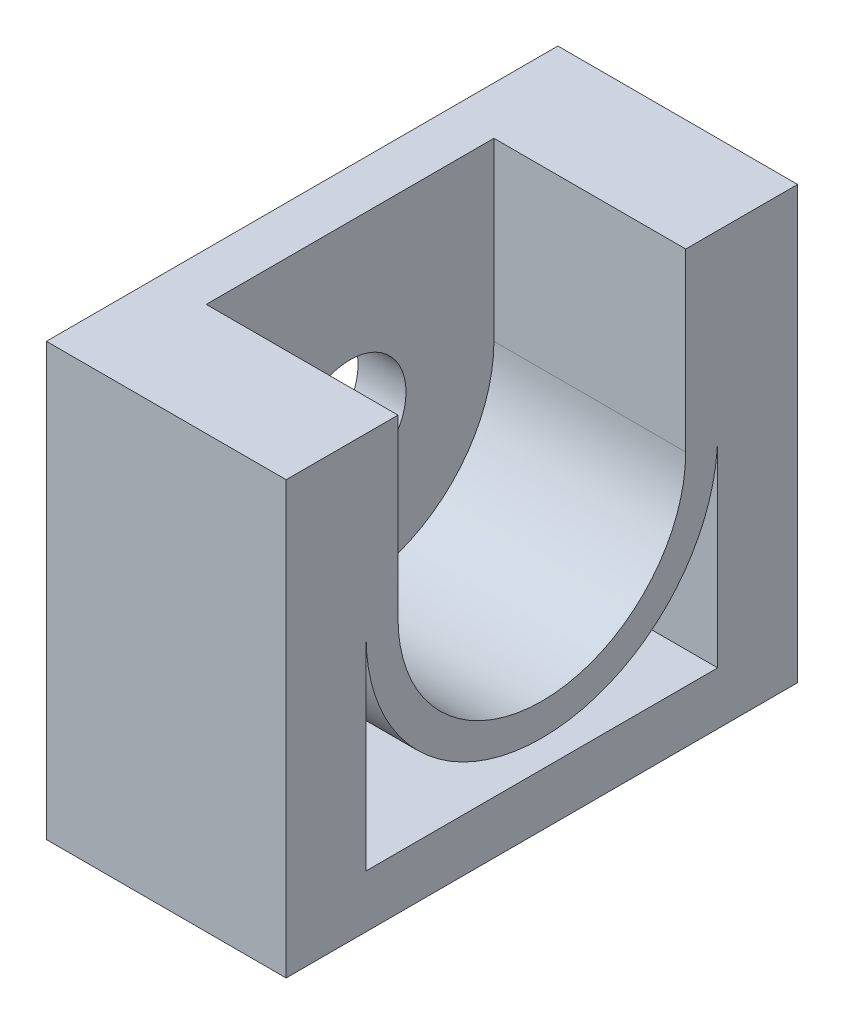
SolidWorks part; units mm, degrees
ref_plane "Front Plane" through (0, 0, 0) normal (0, 0, 1) x (1, 0, 0)
ref_plane "Top Plane" through (0, 0, 0) normal (0, 1, 0) x (1, 0, 0)
ref_plane "Right Plane" through (0, 0, 0) normal (1, 0, 0) x (0, 0, -1)
sketch "Sketch1" plane through (0, 0, 0) normal (1, 0, 0) x (0, 0, -1)
  line L2 (-11, 0) -> (-11, 11)
  line L3 (-11, 11) -> (11, 11)
  line L4 (11, 0) -> (11, 11)
  arc A0 (-11, 0) -> (11, 0) centre (0, 0) ccw
  dimension "D1" = 22
  dimension "D2" = 11
extrude "Boss-Extrude2" add sketch "Sketch1" along normal blind 15
sketch "Sketch2" plane through (15, 0, 0) normal (1, 0, 0) x (0, 0, -1)
  line L0 (11, 11) -> (-11, 11) construction
  line L2 (-9, 0) -> (-9, 11)
  line L3 (-9, 11) -> (9, 11)
  line L4 (9, 0) -> (9, 11)
  arc A0 (-9, 0) -> (9, 0) centre (0, 0) ccw
  dimension "D1" = 18
extrude "Cut-Extrude1" cut sketch "Sketch2" against normal blind 12 contours A0 L4 L3 L2
sketch "Sketch3" plane through (3, 0, 0) normal (1, 0, 0) x (0, 0, -1)
  circle A0 centre (0, 0) radius 3.5
  dimension "D1" = 7
extrude "Cut-Extrude2" cut sketch "Sketch3" against normal through all contours A0
sketch "Sketch4" plane through (0, 0, -11) normal (0, 0, -1) x (-1, 0, 0)
  line L1 (-15, 11) -> (0, 11)
  line L2 (-15, 11) -> (-15, 0)
  line L3 (-15, 0) -> (0, 0)
  line L4 (0, 11) -> (0, 0)
extrude "Boss-Extrude3" add sketch "Sketch4" along normal blind 5 contours L2 L1 L4 L3
sketch "Sketch5" plane through (0, 0, 0) normal (0, -1, 0) x (1, 0, 0)
  line L1 (0, -11) -> (15, -11)
  line L2 (0, -11) -> (0, -16)
  line L3 (0, -16) -> (15, -16)
  line L4 (15, -11) -> (15, -16)
extrude "Boss-Extrude5" add sketch "Sketch5" along normal blind 16 contours L2 L1 L4 L3
sketch "Sketch6" plane through (0, 0, 11) normal (0, 0, 1) x (1, 0, 0)
  line L1 (0, 11) -> (15, 11)
  line L2 (0, 11) -> (0, 0)
  line L3 (0, 0) -> (15, 0)
  line L4 (15, 11) -> (15, 0)
extrude "Boss-Extrude6" add sketch "Sketch6" along normal blind 5 contours L2 L1 L4 L3
sketch "Sketch7" plane through (0, 0, 0) normal (0, -1, 0) x (1, 0, 0)
  line L1 (0, 16) -> (15, 16)
  line L2 (0, 16) -> (0, 11)
  line L3 (0, 11) -> (15, 11)
  line L4 (15, 16) -> (15, 11)
extrude "Boss-Extrude7" add sketch "Sketch7" along normal blind 16 contours L2 L1 L4 L3
sketch "Sketch8" plane through (0, 0, 11) normal (0, 0, -1) x (-1, 0, 0)
  line L0 (0, -16) -> (0, 0) construction
  line L1 (-15, -16) -> (0, -16)
  line L2 (-15, -16) -> (-15, -12.6972)
  line L3 (-15, -12.6972) -> (0, -12.6972)
  line L4 (0, -16) -> (0, -12.6972)
  dimension "D1" = 3.3028
extrude "Boss-Extrude9" add sketch "Sketch8" along normal up to surface (22 mm away) contours L2 L1 L4 L3
